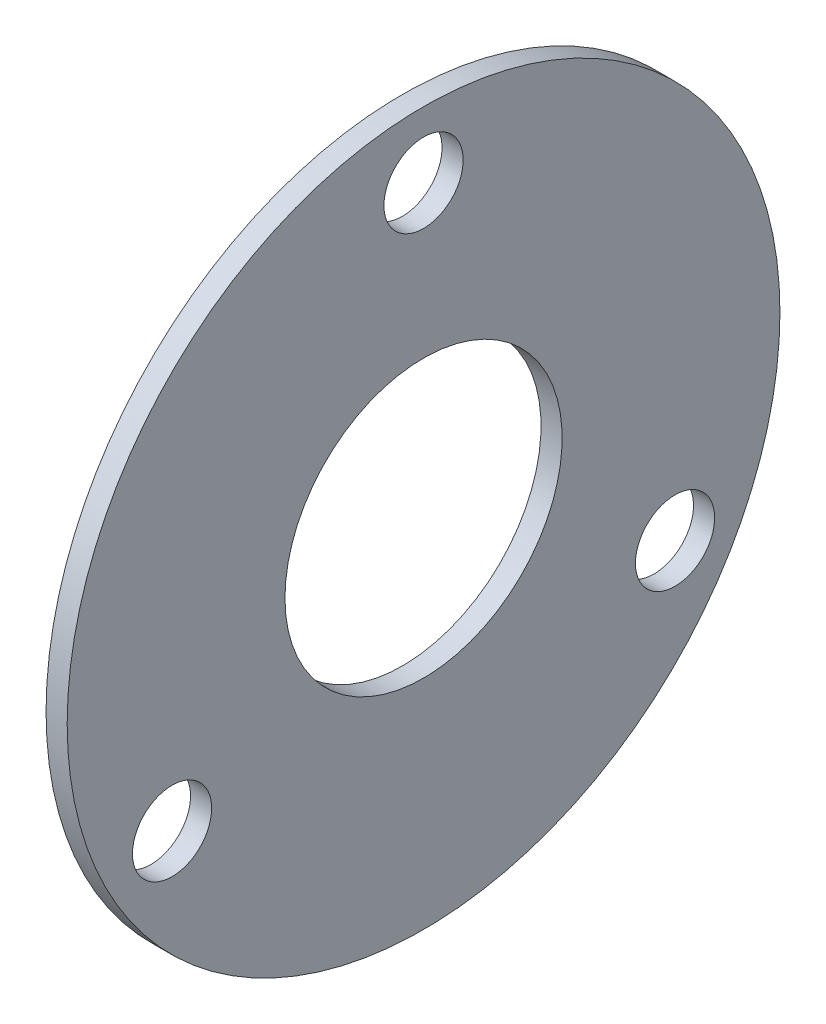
SolidWorks part; units mm, degrees
ref_plane "Face" through (0, 0, 0) normal (0, 0, 1) x (1, 0, 0)
ref_plane "Dessus" through (0, 0, 0) normal (0, 1, 0) x (1, 0, 0)
ref_plane "Droite" through (0, 0, 0) normal (1, 0, 0) x (0, 0, -1)
sketch "Esquisse2" plane through (-7.3, 0, 0) normal (-1, 0, 0) x (0, 0, 1)
  circle A0 centre (0, 0) radius 13.5
  dimension "D1" = 27
extrude "Extrusion1" add sketch "Esquisse2" along normal blind 0.8
sketch "Esquisse3" plane through (-8.1, 0, 0) normal (-1, 0, 0) x (0, 0, 1)
  circle A0 centre (0, 11) radius 1.5
  dimension "D1" = 3
extrude "Enlèv. mat.-Extru.1" cut sketch "Esquisse3" against normal through all
pattern_circular "Répétition circulaire1" count 3 every 120
sketch "Esquisse4" plane through (-8.1, 0, 0) normal (-1, 0, 0) x (0, 0, 1)
  circle A0 centre (0, 0) radius 5.25
  dimension "D1" = 10.5
extrude "Enlèv. mat.-Extru.2" cut sketch "Esquisse4" against normal through all
